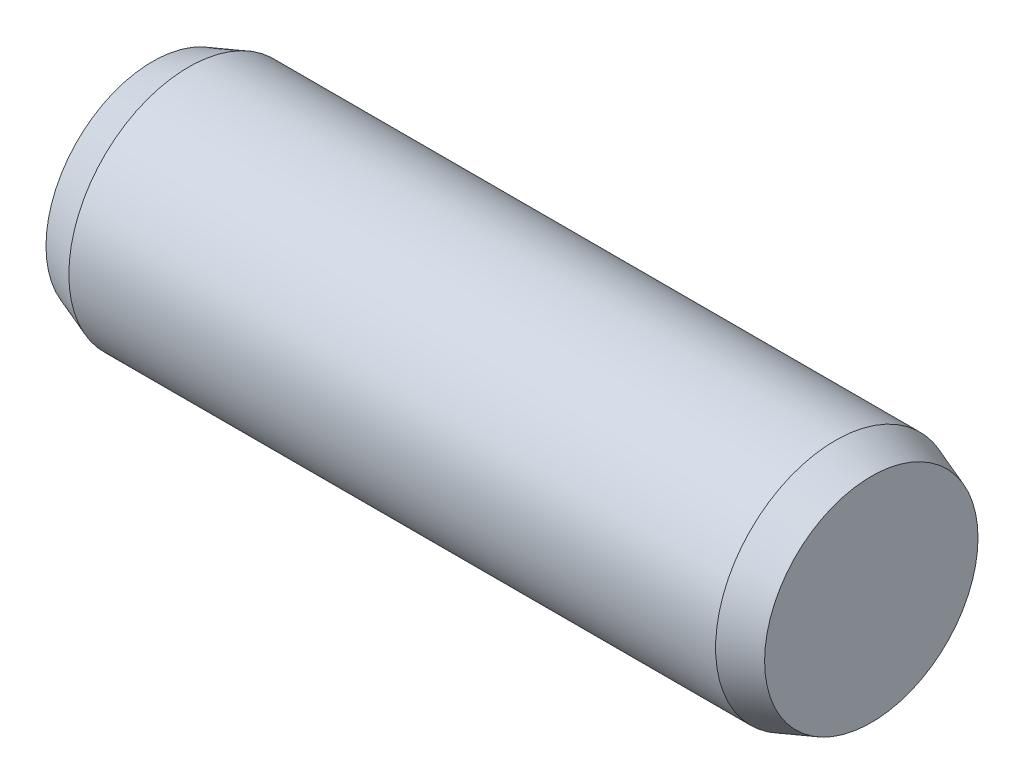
SolidWorks part; units mm, degrees
other "<PINL-M020-006-S>-<Imported1>"
ref_plane "Front Plane" through (0, 0, 0) normal (0, 0, 1) x (1, 0, 0)
ref_plane "Top Plane" through (0, 0, 0) normal (0, 1, 0) x (1, 0, 0)
ref_plane "Right Plane" through (0, 0, 0) normal (1, 0, 0) x (0, 0, -1)
mirrored part "PINL-M020-006-S_Mirrored"
